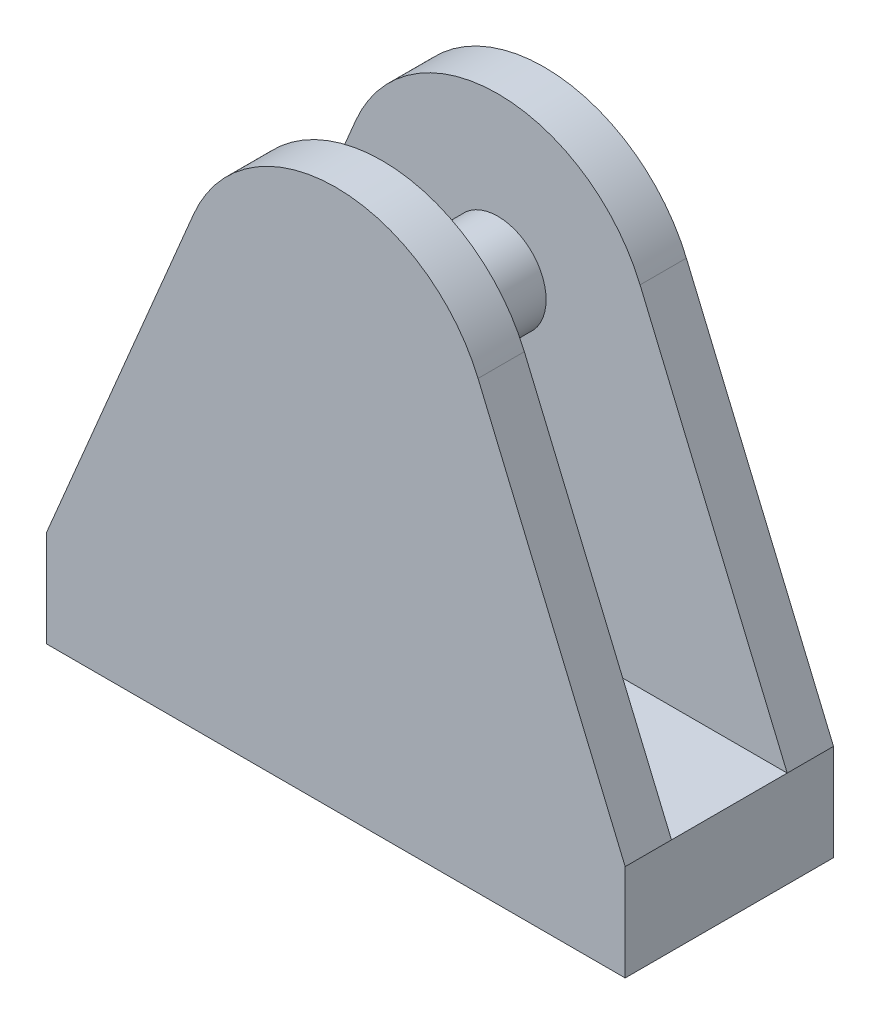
SolidWorks part; units mm, degrees
ref_plane "Front Plane" through (0, 0, 0) normal (0, 0, 1) x (1, 0, 0)
ref_plane "Top Plane" through (0, 0, 0) normal (0, 1, 0) x (1, 0, 0)
ref_plane "Right Plane" through (0, 0, 0) normal (1, 0, 0) x (0, 0, -1)
sketch "Sketch1" plane through (0, 0, 0) normal (0, 0, 1) x (1, 0, 0)
  line L0 (0, 0) -> (150, 0)
  line L1 (150, 0) -> (150, 25)
  line L2 (150, 25) -> (111.8625, 115.5292)
  line L3 (38.1375, 115.5292) -> (0, 25)
  line L4 (0, 25) -> (0, 0)
  arc A0 (111.8625, 115.5292) -> (38.1375, 115.5292) centre (75, 100) ccw
  dimension "D3" = 40
  dimension "D1" = 25
  dimension "D2" = 150
  dimension "D4" = 100
extrude "Boss-Extrude1" add sketch "Sketch1" along normal blind 54
sketch "Sketch2" plane through (150, 0, 0) normal (1, 0, 0) x (0, 0, -1)
  line L0 (-54, 25) -> (0, 25) construction
  line L1 (-42, 25) -> (-12, 25)
  line L2 (-42, 25) -> (-42, 188.9081)
  line L3 (-42, 188.9081) -> (-12, 188.9081)
  line L4 (-12, 25) -> (-12, 188.9081)
  line L5 (0, 25) -> (0, 115.5292) construction
  line L6 (-54, 25) -> (-54, 115.5292) construction
  dimension "D1" = 12
  dimension "D2" = 12
extrude "Cut-Extrude1" cut sketch "Sketch2" against normal through all
sketch "Sketch4" plane through (0, 0, 54) normal (0, 0, 1) x (1, 0, 0)
  circle A0 centre (75, 100) radius 12.5
  dimension "D1" = 25
extrude "Boss-Extrude2" add sketch "Sketch4" against normal through all
